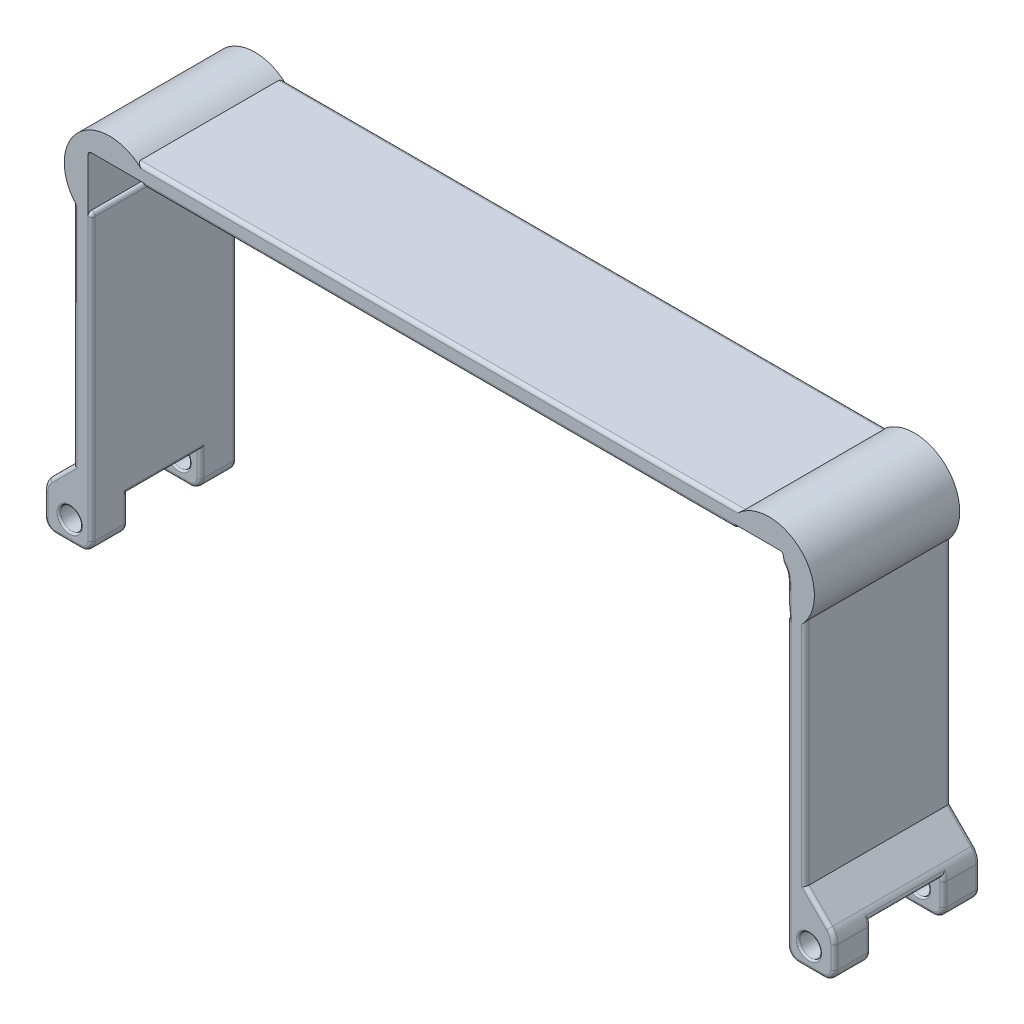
SolidWorks part; units mm, degrees
ref_plane "Front Plane" through (0, 0, 0) normal (0, 0, 1) x (1, 0, 0)
ref_plane "Top Plane" through (0, 0, 0) normal (0, 1, 0) x (1, 0, 0)
ref_plane "Right Plane" through (0, 0, 0) normal (1, 0, 0) x (0, 0, -1)
sketch "Sketch1" plane through (0, 0, 0) normal (0, 0, 1) x (1, 0, 0)
  line L0 (90.75, 95) -> (-90.75, 95)
  line L1 (-95.75, 90) -> (-95.75, 3)
  line L2 (-98.75, 0) -> (-100.75, 0)
  line L3 (-100.75, 0) -> (-100.75, 8.4384)
  line L4 (-95.75, 100) -> (95.75, 100)
  line L6 (0, 0) -> (0, 100) construction
  line L7 (-101.75, 8.61) -> (-101.75, 2.61) construction
  line L8 (-98.75, 5.61) -> (-104.75, 5.61) construction
  line L9 (-100.75, 0) -> (-105.75, 0)
  line L10 (-108.75, 3) -> (-108.75, 9.1075)
  line L11 (-107.2855, 12.643) -> (-100.75, 19.1786)
  line L12 (-100.75, 19.1786) -> (-100.75, 95)
  line L13 (0, 0) -> (-90.75, 90) construction
  line L14 (0, 95) -> (0, 100)
  line L15 (100.75, 0) -> (105.75, 0)
  line L16 (108.75, 3) -> (108.75, 9.1075)
  line L17 (107.2855, 12.643) -> (100.75, 19.1786)
  line L18 (100.75, 19.1786) -> (100.75, 95)
  line L19 (95.75, 90) -> (95.75, 3)
  line L20 (98.75, 0) -> (100.75, 0)
  line L21 (-95.75, 90) -> (-95.75, 95)
  line L22 (-95.75, 95) -> (-87.7013, 95)
  circle A0 centre (-101.75, 5.61) radius 3
  arc A1 (-108.75, 9.1075) -> (-107.2855, 12.643) centre (-103.75, 9.1075) cw
  arc A2 (-90.75, 95) -> (-95.75, 90) centre (-90.75, 90) ccw
  arc A3 (-100.75, 95) -> (-95.75, 100) centre (-95.75, 95) cw
  arc A4 (108.75, 9.1075) -> (107.2855, 12.643) centre (103.75, 9.1075) ccw
  arc A5 (100.75, 95) -> (95.75, 100) centre (95.75, 95) ccw
  arc A6 (90.75, 95) -> (95.75, 90) centre (90.75, 90) cw
  arc A7 (95.75, 3) -> (98.75, 0) centre (98.75, 3) ccw
  arc A8 (-95.75, 3) -> (-98.75, 0) centre (-98.75, 3) cw
  arc A9 (-105.75, 0) -> (-108.75, 3) centre (-105.75, 3) cw
  arc A10 (105.75, 0) -> (108.75, 3) centre (105.75, 3) ccw
  circle A11 centre (101.75, 5.61) radius 3
  point P24 (-98.75, 95)
  point P40 (95.75, 0)
  point P43 (-95.75, 0)
  point P46 (-108.75, 0)
  point P49 (108.75, 0)
  dimension "D5" = 6
  dimension "D8" = 4
  dimension "D10" = 5
  dimension "D11" = 5
  dimension "D12" = 5
  dimension "D14" = 5
  dimension "D16" = 3
  dimension "D2" = 5
  dimension "D3" = 191.5
  dimension "D4" = 95
  dimension "D6" = 6
  dimension "D7" = 5.61
  dimension "D9" = 45
  dimension "D13" = 8.8873
extrude "Boss-Extrude1" add sketch "Sketch1" along normal blind 40
sketch "Sketch2" plane through (108.75, 0, 0) normal (1, 0, 0) x (0, 0, -1)
  line L0 (-10, 0) -> (-10, 10)
  line L1 (-40, 0) -> (0, 0) construction
  line L2 (-10, 10) -> (-30, 10)
  line L3 (-30, 10) -> (-30, 0)
  line L4 (-30, 0) -> (-10, 0)
  line L5 (0, 3) -> (0, 9.1075) construction
  line L6 (-40, 3) -> (-40, 9.1075) construction
  dimension "D1" = 10
  dimension "D2" = 10
  dimension "D3" = 10
extrude "Cut-Extrude1" cut sketch "Sketch2" against normal through all
fillet "Fillet1" radius 1 72 edges at (-107.8713, 0.8787, 40) (108.6697, 10, 20) (-102.25, 0, 10) (102.25, 0, 10) (-108.6697, 10, 20) (-95.75, 10, 20) (95.75, 10, 20) (108.75, 6.0538, 30) (108.75, 6.0538, 10) (-107.8713, 0.8787, 30) (-108.7299, 9.5556, 30) (-95.75, 6.5, 30) (-96.6287, 0.8787, 30) (95.75, 6.5, 30) (96.6287, 0.8787, 30) (102.25, 0, 30) (107.8713, 0.8787, 30) (108.7299, 9.5556, 30) (-102.25, 0, 30) (-108.75, 6.0538, 30) (-107.8713, 0.8787, 10) (-108.7299, 9.5556, 10) (-96.6287, 0.8787, 10) (-95.75, 6.5, 10) (96.6287, 0.8787, 10) (95.75, 6.5, 10) (108.7299, 9.5556, 10) (107.8713, 0.8787, 10) (-108.75, 6.0538, 10) (-108.75, 6.0538, 0) (-108.3694, 11.0209, 0) (-102.25, 0, 40) (-104.0178, 15.9108, 0) (-100.75, 57.0893, 0) (-99.2855, 98.5355, 0) (0, 100, 0) (-96.6287, 0.8787, 0) (-102.25, 0, 0) (-107.8713, 0.8787, 0) (-96.6287, 0.8787, 40) (0, 95, 0) (-95.75, 46.5, 0) (-95.75, 46.5, 40) (0, 95, 40) (0, 100, 40) (-99.2855, 98.5355, 40) (-100.75, 57.0893, 40) (-104.0178, 15.9108, 40) (-94.2855, 93.5355, 40) (-108.3694, 11.0209, 40) (94.2855, 93.5355, 40) (95.75, 46.5, 40) (96.6287, 0.8787, 40) (102.25, 0, 40) (107.8713, 0.8787, 40) (108.75, 6.0538, 40) (108.3694, 11.0209, 40) (104.0178, 15.9108, 40) (100.75, 57.0893, 40) (99.2855, 98.5355, 40) (-108.75, 6.0538, 40) (-94.2855, 93.5355, 0) (94.2855, 93.5355, 0) (95.75, 46.5, 0) (96.6287, 0.8787, 0) (102.25, 0, 0) (107.8713, 0.8787, 0) (108.75, 6.0538, 0) (108.3694, 11.0209, 0) (104.0178, 15.9108, 0) (100.75, 57.0893, 0) (99.2855, 98.5355, 0)
fillet "Fillet2" radius 0.5 8 edges at (101.75, 8.61, 10) (104.75, 5.61, 40) (104.75, 5.61, 30) (104.75, 5.61, 0) (-98.75, 5.61, 0) (-98.75, 5.61, 30) (-101.75, 8.61, 10) (-98.75, 5.61, 40)
sketch "Sketch4" plane through (0, 0, 40) normal (0, 0, 1) x (1, 0, 0)
  line L0 (-97.25, 90) -> (-97.25, 79.3229)
  line L1 (-79.7841, 96) -> (-88.25, 96)
  line L2 (-90.75, 96) -> (90.75, 96) construction
  line L3 (0, 0) -> (0, 146.1509) construction
  line L4 (79.7841, 96) -> (88.25, 96)
  line L5 (97.25, 90) -> (97.25, 79.3229)
  arc A0 (-79.7841, 96) -> (-97.25, 79.3229) centre (-90.75, 90) ccw
  arc A1 (-88.25, 96) -> (-97.25, 90) centre (-90.75, 90) ccw
  arc A2 (88.25, 96) -> (97.25, 90) centre (90.75, 90) cw
  arc A3 (79.7841, 96) -> (97.25, 79.3229) centre (90.75, 90) cw
  dimension "D1" = 25
  dimension "D2" = 13
extrude "Boss-Extrude2" add sketch "Sketch4" against normal up to surface (40 mm away)
sketch "Sketch5" plane through (0, 0, 40) normal (0, 0, 1) x (1, 0, 0)
  line L0 (-99.75, 81.3253) -> (-80.8546, 81.3253) construction
  line L1 (82.0753, 96) -> (82.0753, 95)
  line L2 (-82.0753, 99) -> (-82.0753, 79.8928) construction
  line L3 (82.0753, 95) -> (81.0753, 95)
  line L4 (96.75, 81.3253) -> (95.75, 81.3253)
  line L5 (-96.75, 81.3253) -> (-96.75, 95)
  line L6 (-96.75, 3) -> (-96.75, 90) construction
  line L7 (-82.0753, 96) -> (-93.75, 96)
  line L8 (-90.75, 96) -> (90.75, 96) construction
  line L9 (-95.75, 82.3253) -> (-81.0639, 95)
  line L10 (0, 0) -> (0, 128.6421) construction
  line L11 (95.75, 82.3253) -> (81.0753, 95)
  line L12 (82.0753, 96) -> (93.75, 96)
  line L13 (96.75, 81.3253) -> (94.75, 95)
  line L14 (-96.75, 81.3253) -> (-93.7404, 81.3253)
  line L15 (-93.7404, 81.3253) -> (-95.75, 82.3253)
  line L16 (-95.75, 90) -> (-95.75, 3) construction
  line L17 (-81.0639, 95) -> (-82.0753, 95)
  line L18 (95.75, 3) -> (95.75, 90) construction
  line L19 (-82.0753, 95) -> (-82.0753, 96)
  line L20 (95.75, 81.3253) -> (95.75, 82.3253)
  line L21 (90.75, 95) -> (-90.75, 95) construction
  line L23 (-96.75, 95) -> (-96.75, 96)
  line L24 (-96.75, 96) -> (-93.75, 96)
  line L25 (93.75, 96) -> (94.75, 96)
  line L26 (94.75, 96) -> (94.75, 95)
  dimension "D1" = 0
extrude "Cut-Extrude4" cut sketch "Sketch5" against normal through all contours L20 L4 L1 L3 L11 M20 M19 M18 | L17 L19 L14 L15 L9 M18 M17 M16
fillet "Fillet3" radius 1 12 edges at (-82.0753, 95.2929, 0.2929) (-82.0753, 95.2929, 39.7071) (-96.0429, 81.3253, 39.7071) (-96.0429, 81.3253, 0.2929) (82.0753, 95.2929, 0.2929) (82.0753, 95.2929, 39.7071) (96.0429, 81.3253, 0.2929) (96.0429, 81.3253, 39.7071) (-82.0753, 95, 20) (-95.75, 81.3253, 20) (82.0753, 95, 20) (95.75, 81.3253, 20)
fillet "Fillet4" radius 1 4 edges at (-96.75, 96, 20) (94.75, 95.5, 0) (94.75, 95.5, 40) (94.75, 96, 20)
